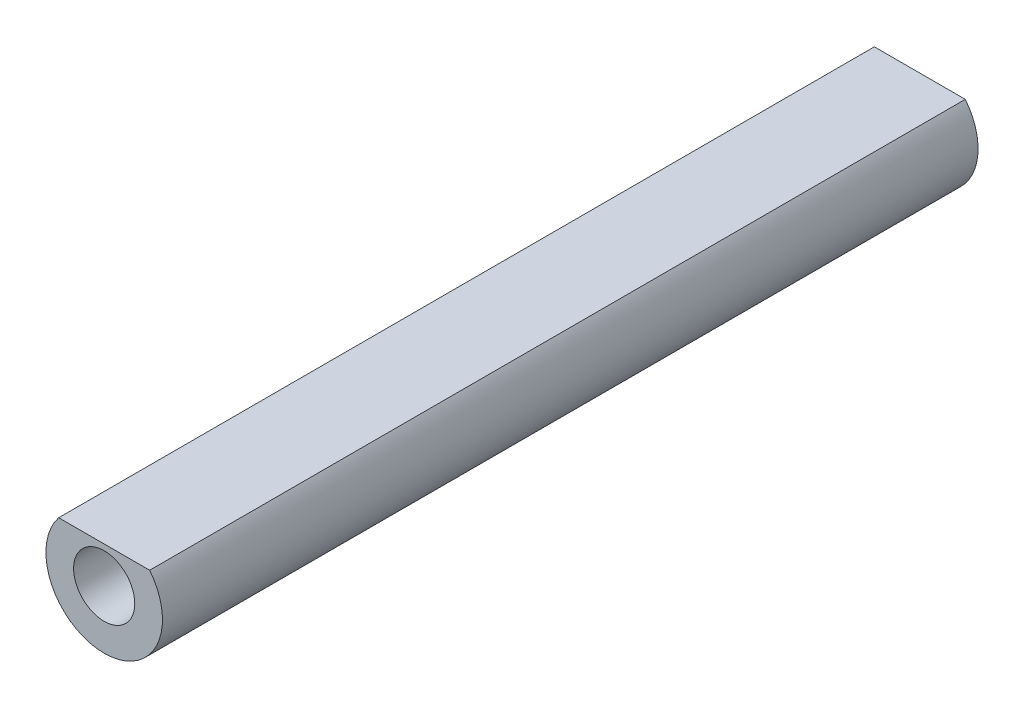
SolidWorks part; units mm, degrees
ref_plane "Face" through (0, 0, 0) normal (0, 0, 1) x (1, 0, 0)
ref_plane "Dessus" through (0, 0, 0) normal (0, 1, 0) x (1, 0, 0)
ref_plane "Droite" through (0, 0, 0) normal (1, 0, 0) x (0, 0, -1)
sketch "Esquisse1" plane through (0, 0, 0) normal (0, 0, 1) x (1, 0, 0)
  circle A0 centre (0, 0) radius 4
  dimension "D1" = 8
extrude "Extrusion1" add sketch "Esquisse1" along normal blind 28
hole_wizard "Trou taraudé M51" positions "Esquisse3" profile "Esquisse2" tap size "M5" standard "ISO"
sketch "Esquisse3" plane through (0, 0, 28) normal (0, 0, 1) x (1, 0, 0)
  point P0 (0, 0)
sketch "Esquisse2" plane through (0, 0, 28) normal (1, 0, 0) x (0, -1, 0)
  line L0 (0, 0) -> (0, 15.6618)
  line L1 (0, 15.6618) -> (2.1, 14.4)
  line L2 (2.1, 14.4) -> (2.1, 0)
  line L5 (2.1, 0) -> (0, 0)
  line L10 (0, 15.6618) -> (-2.1, 14.4) construction
  line L11 (0, -6.35) -> (0, 107.95) construction
  dimension "Diamètre du trou pour taraudage" = 4.2
  dimension "Profondeur du trou pour taraudage" = 14.4
  dimension "Angle de pointe" = 118
sketch "Esquisse4" plane through (0, 0, 0) normal (0, 0, 1) x (1, 0, 0)
  line L1 (-5.1661, 4.7731) -> (4.661, 4.7731)
  line L2 (-5.1661, 4.7731) -> (-5.1661, 2.5)
  line L3 (-5.1661, 2.5) -> (4.661, 2.5)
  line L4 (4.661, 4.7731) -> (4.661, 2.5)
  dimension "D1" = 2.5
extrude "Enlèv. mat.-Extru.1" cut sketch "Esquisse4" along normal through all
mirror "Symétrie1" about plane through (0, 0, 0) normal (0, 0, 1)
